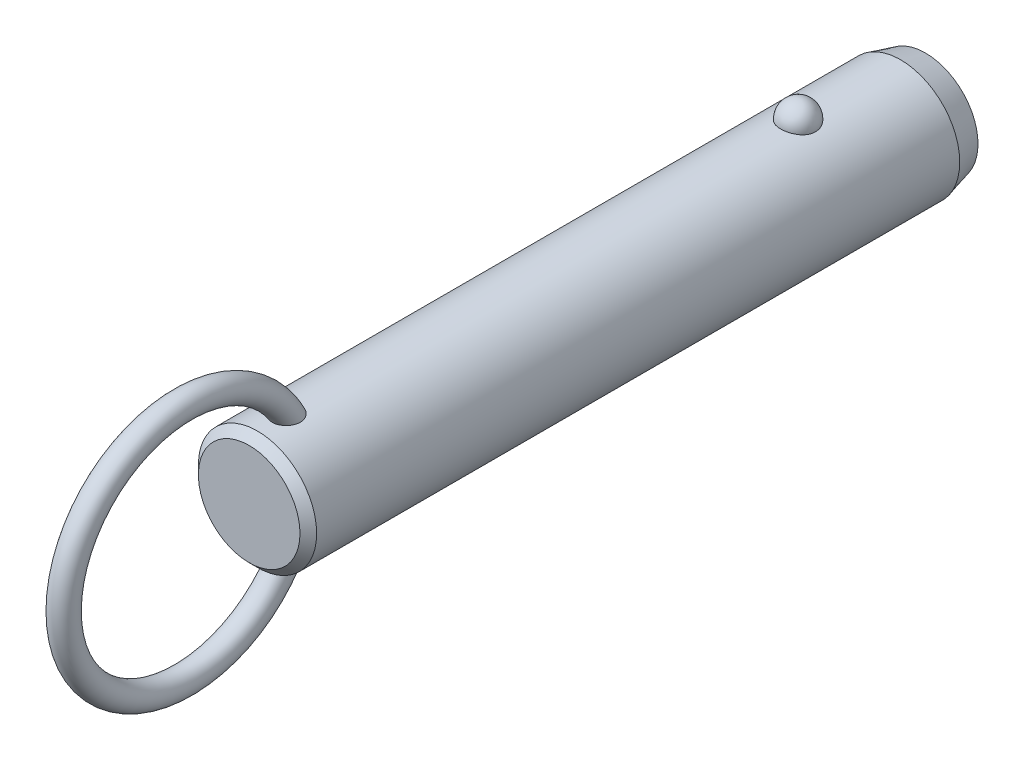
SolidWorks part; units mm, degrees
ref_plane "Front Plane" through (0, 0, 0) normal (0, 0, 1) x (1, 0, 0)
ref_plane "Top Plane" through (0, 0, 0) normal (0, 1, 0) x (1, 0, 0)
ref_plane "Right Plane" through (0, 0, 0) normal (1, 0, 0) x (0, 0, -1)
sketch "Sketch2" plane through (0, 0, 0) normal (0, 0, 1) x (1, 0, 0)
  circle A0 centre (0, 0) radius 7.1
  point P3 (0, 7.1)
  dimension "D1" = 14.2
extrude "Boss-Extrude1" add sketch "Sketch2" along normal blind 55.9
sketch "Sketch3" plane through (0, 0, 0) normal (0, 0, -1) x (-1, 0, 0)
  circle A0 centre (0, 0) radius 7.1
  dimension "D1" = 14.2
extrude "Boss-Extrude2" add sketch "Sketch3" along normal blind 17.4
chamfer "Chamfer1" distance 3 angle 15 1 edges at (-7.1, 0, -17.4)
sketch "Sketch12" plane through (0, 0, 0) normal (1, 0, 0) x (0, 0, -1)
  line L0 (-55.9, 7.1) -> (-55.9, -7.1) construction
  point P0 (-55.9, 0)
sketch "Sketch13" plane through (0, 0, 0) normal (1, 0, 0) x (0, 0, -1)
  circle A0 centre (-71.75, 0) radius 15.85
  point P2 (-55.9, 0)
  dimension "D1" = 31.7
sketch "Sketch14" plane through (0, 0, 0) normal (0, 1, 0) x (1, 0, 0)
  circle A0 centre (0, -57.4) radius 1.5
  point P2 (0, -55.9)
  dimension "D1" = 3
sweep "Sweep1" add profiles "Sketch14" path "Sketch13"
sketch "Sketch15" plane through (0, 0, 55.9) normal (0, 0, 1) x (1, 0, 0)
  circle A0 centre (0, 0) radius 7.1
  dimension "D1" = 14.2
extrude "Boss-Extrude3" add sketch "Sketch15" along normal blind 7.92
chamfer "Chamfer2" distance 1 angle 45 1 edges at (7.1, 0, 63.82)
sketch "Sketch18" plane through (0, 0, 0) normal (1, 0, 0) x (0, 0, -1)
  line L0 (14.4, 7.1) -> (-57.5792, 7.1) construction
  line L1 (2.1, 9.2) -> (2.1, 5)
  line L2 (-57.5792, -7.1) -> (14.4, -7.1) construction
  arc A0 (2.1, 9.2) -> (2.1, 5) centre (2.1, 7.1) ccw
  point P4 (0, 7.1)
  dimension "D1" = 16.3
revolve "Revolve1" add sketch "Sketch18" angle 360 about L1
